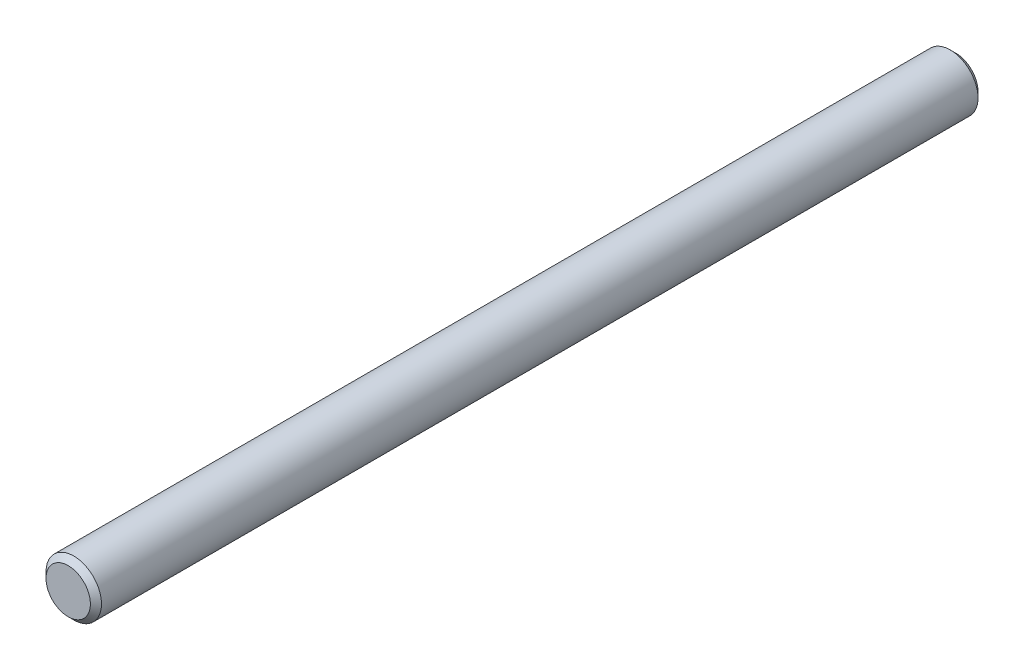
SolidWorks part; units mm, degrees
ref_plane "Front Plane" through (0, 0, 0) normal (0, 0, 1) x (1, 0, 0)
ref_plane "Top Plane" through (0, 0, 0) normal (0, 1, 0) x (1, 0, 0)
ref_plane "Right Plane" through (0, 0, 0) normal (1, 0, 0) x (0, 0, -1)
sketch "Sketch1" plane through (0, 0, 0) normal (0, 0, 1) x (1, 0, 0)
  line L0 (-1.5875, 0) -> (1.5875, 0) construction
  circle A0 centre (0, 0) radius 1.5875
  point P3 (-1.5875, 0)
  point P4 (1.5875, 0)
  dimension "OD" = 3.175
extrude "Extrude1" add sketch "Sketch1" along normal mid plane 50.8
chamfer "Chamfer1" distance 0.3175 angle 45 2 edges at (1.5875, 0, -25.4) (1.5875, 0, 25.4)
equation "\"D1@Chamfer1\" = \"OD@Sketch1\"*.1"
